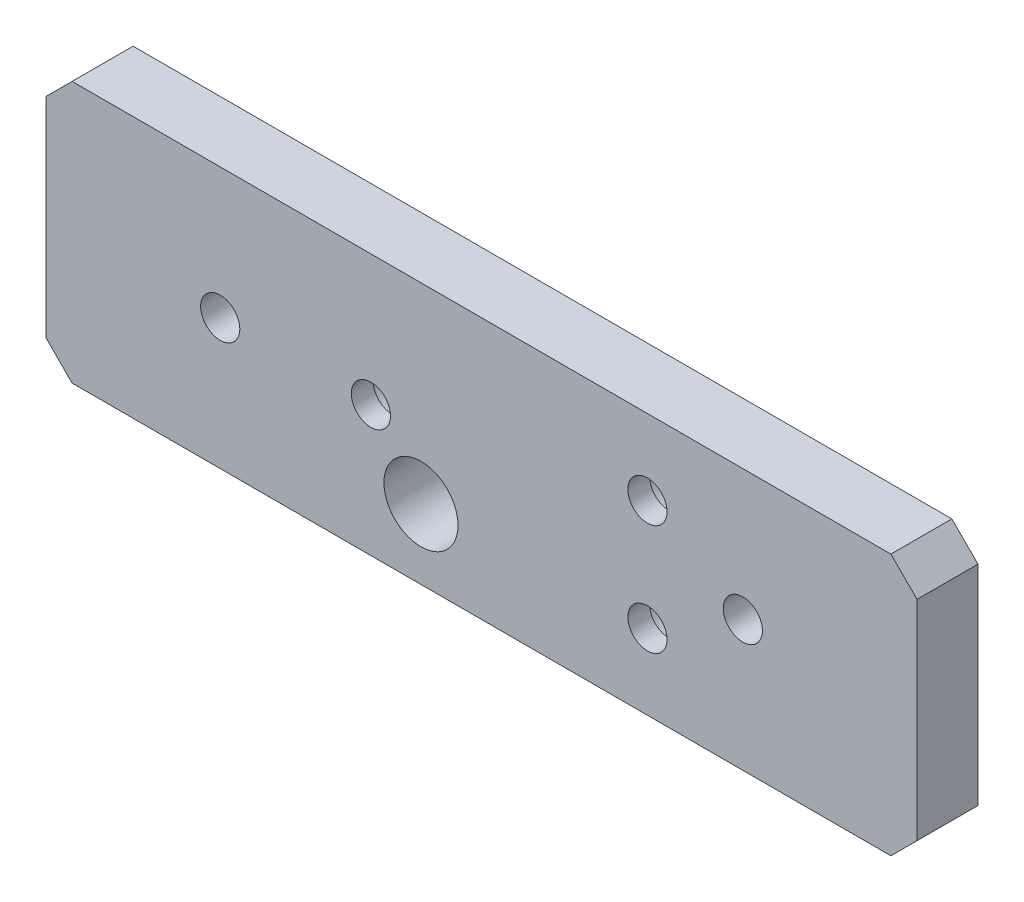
SolidWorks part; units mm, degrees
ref_plane "Plan de face" through (0, 0, 0) normal (0, 0, 1) x (1, 0, 0)
ref_plane "Plan de dessus" through (0, 0, 0) normal (0, 1, 0) x (1, 0, 0)
ref_plane "Plan de droite" through (0, 0, 0) normal (1, 0, 0) x (0, 0, -1)
sketch "Esquisse1" plane through (0, 0, 0) normal (0, 0, 1) x (1, 0, 0)
  line L1 (164, -40) -> (-42, -40)
  line L2 (164, -40) -> (164, 0)
  line L3 (164, 0) -> (-42, 0)
  line L4 (-42, -40) -> (-42, 0)
  dimension "D1" = 40
  dimension "D2" = 206
extrude "Boss.-Extru.1" add sketch "Esquisse1" along normal blind 7
sketch "Esquisse2" plane through (0, 0, 0) normal (0, 0, -1) x (-1, 0, 0)
  line L1 (-164, 0) -> (-44, 0)
  line L2 (-164, 0) -> (-164, -10)
  line L3 (-164, -10) -> (-44, -10)
  line L4 (-44, 0) -> (-44, -10)
  dimension "D1" = 120
  dimension "D2" = 10
extrude "Enlèv. mat.-Extru.1" cut sketch "Esquisse2" against normal through all
sketch "Esquisse3" plane through (0, 0, 0) normal (0, 0, -1) x (-1, 0, 0)
  line L1 (42, -40) -> (-29.5315, -40)
  line L2 (42, -40) -> (42, -13.7137)
  line L3 (42, -13.7137) -> (-29.5315, -13.7137)
  line L4 (-29.5315, -40) -> (-29.5315, -13.7137)
extrude "Enlèv. mat.-Extru.2" cut sketch "Esquisse3" against normal through all
fillet "Congé1" radius 20 1 edges at (29.5315, -13.7137, 3.5)
fillet "Congé2" radius 6 1 edges at (44, -10, 3.5)
hole_wizard "Dégagement M41" positions "Esquisse4" profile "Esquisse5" hole size "M4" standard "Ansi Metric"
sketch "Esquisse4" plane through (0, 0, 7) normal (0, 0, 1) x (1, 0, 0)
  line L0 (164, -10) -> (50, -10) construction
  point P0 (134, -25)
  point P3 (74, -25)
  dimension "D1" = 60
  dimension "D2" = 15
sketch "Esquisse5" plane through (134, -25, 7) normal (1, 0, 0) x (0, -1, 0)
  line L0 (0, 0) -> (0, 7)
  line L1 (0, 7) -> (2.25, 7)
  line L2 (2.25, 7) -> (2.25, 0)
  line L5 (2.25, 0) -> (0, 0)
  line L11 (0, -6.35) -> (0, 107.95) construction
  dimension "Diamètre du perçage jusqu'au prochain" = 4.5
  dimension "Profondeur du perçage jusqu'au prochain" = 7
sketch "Esquisse6" plane through (0, 0, 0) normal (0, 0, -1) x (-1, 0, 0)
  circle A0 centre (-123.05, -18.65) radius 2.25
  circle A1 centre (-123.05, -31.35) radius 2.25
  circle A2 centre (-91.3, -25) radius 2.25
  dimension "D1" = 4.5
  dimension "D2" = 4.5
extrude "Enlèv. mat.-Extru.3" cut sketch "Esquisse6" against normal blind 10
sketch "Esquisse7" plane through (0, 0, 0) normal (0, 0, -1) x (-1, 0, 0)
  circle A0 centre (-123.05, -31.35) radius 4
  circle A1 centre (-123.05, -18.65) radius 4
  circle A2 centre (-91.3, -25) radius 4
  dimension "D1" = 8
extrude "Enlèv. mat.-Extru.4" cut sketch "Esquisse7" against normal blind 4.5
sketch "Esquisse8" plane through (0, 0, 0) normal (0, 0, -1) x (-1, 0, 0)
  line L1 (-54, 11.6719) -> (54.6327, 11.6719)
  line L2 (-54, 11.6719) -> (-54, -62.5825)
  line L3 (-54, -62.5825) -> (54.6327, -62.5825)
  line L4 (54.6327, 11.6719) -> (54.6327, -62.5825)
  line L5 (-29.5315, -40) -> (-164, -40) construction
  line L6 (-164, -10) -> (-154, -10)
  line L7 (-164, -10) -> (-164, -40)
  line L8 (-164, -40) -> (-154, -40)
  line L9 (-154, -10) -> (-154, -40)
  dimension "D1" = 100
  dimension "D2" = 10
extrude "Enlèv. mat.-Extru.5" cut sketch "Esquisse8" against normal through all
sketch "Esquisse9" plane through (54, 0, 0) normal (-1, 0, 0) x (0, 0, 1)
  line L4 (7, -40) -> (7, -10)
  line L5 (7, -10) -> (0, -10)
  line L6 (0, -10) -> (0, -40)
  line L7 (0, -40) -> (7, -40)
  line L8 (7, -40) -> (7, -10)
  line L9 (7, -10) -> (0, -10)
  line L10 (0, -10) -> (0, -40)
  line L11 (0, -40) -> (7, -40)
  dimension "D1" = 0
extrude "Boss.-Extru.2" [suppressed] add sketch "Esquisse9" along normal blind 100
sketch "Esquisse10" [suppressed] plane through (0, -10, 0) normal (0, 1, 0) x (1, 0, 0)
  line L1 (42, 95) -> (42, 15) construction
  line L2 (-46, -7) -> (42, -7)
  line L3 (-46, -7) -> (-46, 38)
  line L4 (-46, 38) -> (42, 38)
  line L5 (42, -7) -> (42, 38)
  dimension "D1" = 45
extrude "Boss.-Extru.3" [suppressed] add sketch "Esquisse10" along normal blind 6
chamfer "Chanfrein1" distance 3 angle 45 4 edges at (54, -10, 3.5) (54, -40, 3.5) (154, -10, 3.5) (154, -40, 3.5)
sketch "Esquisse11" plane through (0, 0, 0) normal (0, 0, -1) x (-1, 0, 0)
  line L0 (-151, -10) -> (-57, -10) construction
  circle A0 centre (-97.05, -32) radius 4.25
  circle A1 centre (-123.05, -31.35) radius 4 construction
  dimension "D2" = 26
  dimension "D3" = 8.5
  dimension "D1" = 22
extrude "Enlèv. mat.-Extru.6" cut sketch "Esquisse11" against normal blind 10
